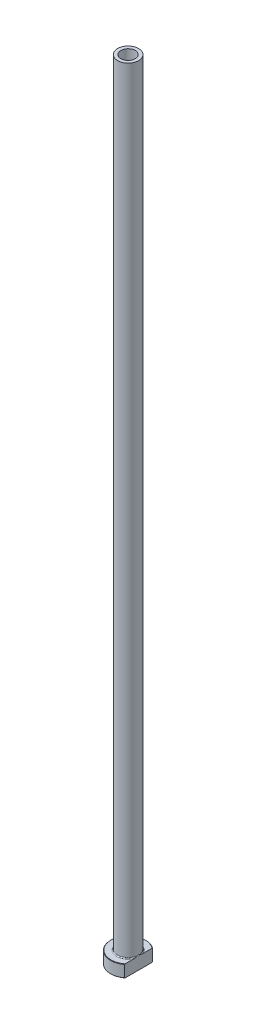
SolidWorks part; units mm, degrees
ref_plane "Front Plane" through (0, 0, 0) normal (0, 0, 1) x (1, 0, 0)
ref_plane "Top Plane" through (0, 0, 0) normal (0, 1, 0) x (1, 0, 0)
ref_plane "Right Plane" through (0, 0, 0) normal (1, 0, 0) x (0, 0, -1)
sketch "Sketch1" plane through (0, 0, 0) normal (0, 0, 1) x (1, 0, 0)
  line L0 (-4.1, 450) -> (-6, 450)
  line L1 (-6, 450) -> (-6, 7)
  line L2 (-6, 7) -> (-10, 7)
  line L3 (-10, 7) -> (-10, 0)
  line L4 (8.8, 0) -> (-8.8, 0) construction
  line L5 (-10, 0) -> (-4.35, 0)
  line L6 (-4.1, 405) -> (-4.1, 450)
  line L7 (0, 92.1877) -> (0, -15.5353) construction
  line L8 (0, -11) -> (0, 11) construction
  line L9 (-4.1, 405) -> (-4.35, 393)
  line L10 (-4.35, 393) -> (-4.35, 0)
  dimension "D1" = 0.25
  dimension "ID" = 8.2
  dimension "OD" = 12
  dimension "L" = 450
  dimension "H" = 20
  dimension "T" = 7
  dimension "N" = 45
  dimension "D2" = 12
  dimension "L-N" = 405
revolve "Revolve1" add sketch "Sketch1" angle 360 about L7
fillet "Fillet1" radius 0.5 1 edges at (0, 7, 6)
chamfer "Chamfer1" distance 0.2 angle 45 2 edges at (0, 7, 10) (0, 0, 10)
sketch "Sketch2" plane through (0, 0, 0) normal (0, -1, 0) x (1, 0, 0)
  line L0 (6, 8) -> (6, -8)
  circle A0 centre (0, 0) radius 10 construction
  arc A1 (6, 8) -> (6, -8) centre (0, 0) cw
  circle A2 centre (0, 0) radius 6 construction
extrude "Cut-Extrude1" cut sketch "Sketch2" against normal through all
chamfer "Chamfer2" distance 0.5 angle 45 1 edges at (0, 0, 4.35)
